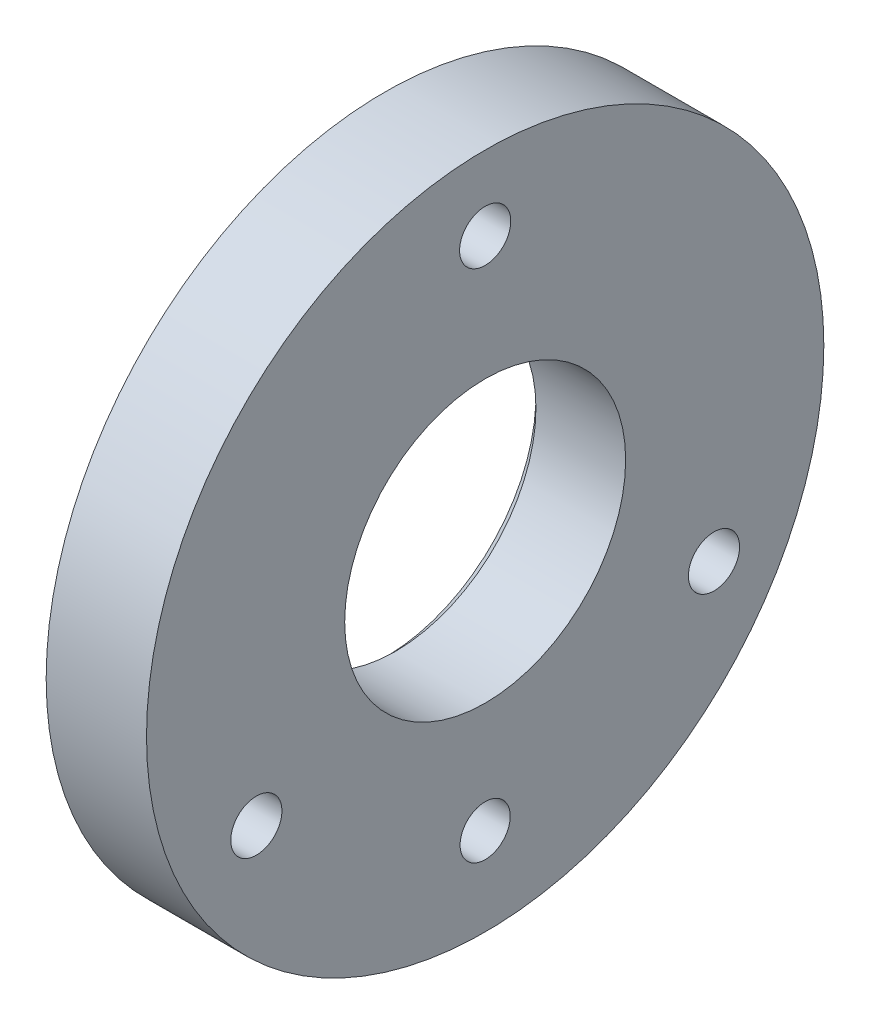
SolidWorks part; units mm, degrees
ref_plane "Front Plane" through (0, 0, 0) normal (0, 0, 1) x (1, 0, 0)
ref_plane "Top Plane" through (0, 0, 0) normal (0, 1, 0) x (1, 0, 0)
ref_plane "Right Plane" through (0, 0, 0) normal (1, 0, 0) x (0, 0, -1)
sketch "Sketch2" plane through (0, 0, 0) normal (0, 0, 1) x (1, 0, 0)
  line L0 (0, 61.5609) -> (20, 61.5609)
  line L1 (20, 61.5609) -> (20, 22.0609)
  line L2 (20, 22.0609) -> (2.1213, 22.0609)
  line L3 (2.1213, 22.0609) -> (0, 24.1822)
  line L4 (0, 24.1822) -> (0, 61.5609)
  line L5 (-82.0652, -5.9391) -> (81.7293, -5.9391) construction
  dimension "D1" = 20
  dimension "D2" = 67.5
  dimension "D3" = 28
  dimension "D4" = 3
  dimension "D5" = 45
revolve "Revolve1" add sketch "Sketch2" angle 360 about L5
sketch "Sketch6" plane through (0, 0, 0) normal (-1, 0, 0) x (0, 0, 1)
  line L0 (0, -36.0604) -> (0, -90.409) construction
  circle A0 centre (0, -5.9391) radius 30.1213 construction
  circle A1 centre (0, -55.9391) radius 5
  circle A2 centre (0, -5.9391) radius 28 construction
  dimension "D1" = 5
  dimension "D2" = 50
extrude "Cut-Extrude1" cut sketch "Sketch6" against normal blind 39
sketch "Sketch7" plane through (0, 0, 0) normal (-1, 0, 0) x (0, 0, 1)
  line L0 (0, 80.5359) -> (0, -87.0889) construction
  point P5 (0, 46.7235)
  point P8 (0, -3.2765)
  dimension "D1" = 50
hole_wizard "M12 Tapped Hole1" positions "Sketch7" profile "Sketch8" tap size "M12" standard "ISO"
sketch "Sketch8" plane through (0, -3.2765, 0) normal (0, 1, 0) x (0, 0, 1)
  line L0 (0, 0) -> (0, 20)
  line L1 (0, 20) -> (5.1, 20)
  line L2 (5.1, 20) -> (5.1, 0)
  line L5 (5.1, 0) -> (0, 0)
  line L11 (0, -6.35) -> (0, 107.95) construction
  dimension "Thru Tap Drill Dia." = 10.2
  dimension "Thru Tap Drill Depth" = 20
pattern_circular "CirPattern1" count 3 over 360 about axis through (0, -5.9391, 0) along (1, 0, 0) of "M12 Tapped Hole1"
